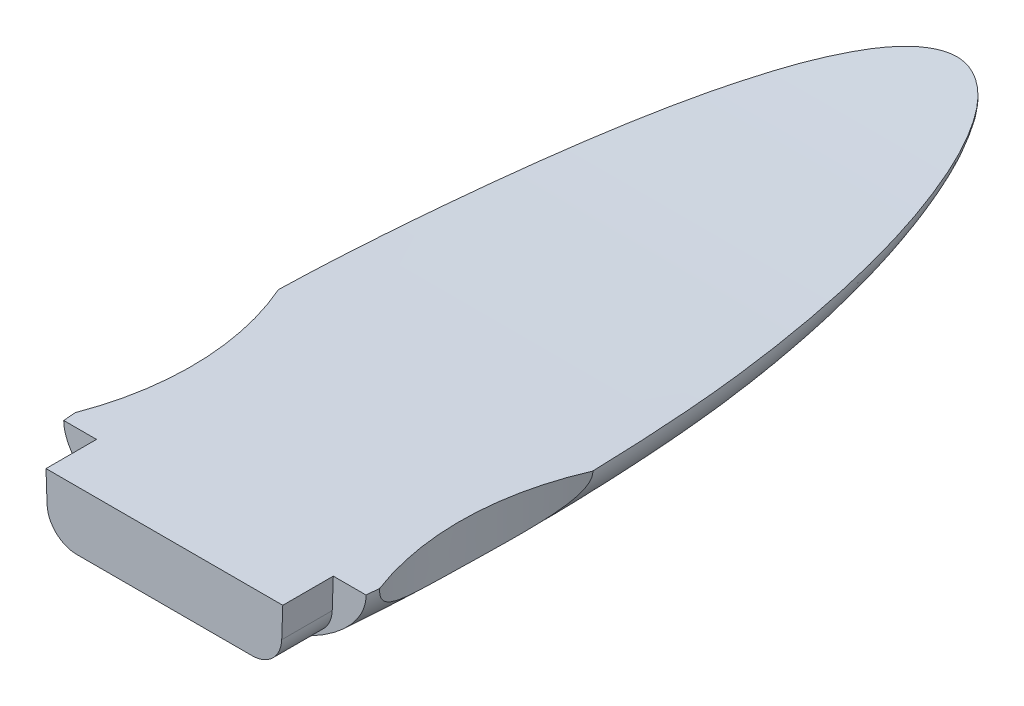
SolidWorks part; units mm, degrees
ref_plane "Front Plane" through (0, 0, 0) normal (0, 0, 1) x (1, 0, 0)
ref_plane "Top Plane" through (0, 0, 0) normal (0, 1, 0) x (1, 0, 0)
ref_plane "Right Plane" through (0, 0, 0) normal (1, 0, 0) x (0, 0, -1)
body saved out of another part "Stock-USB Flash Drive_&-1"
